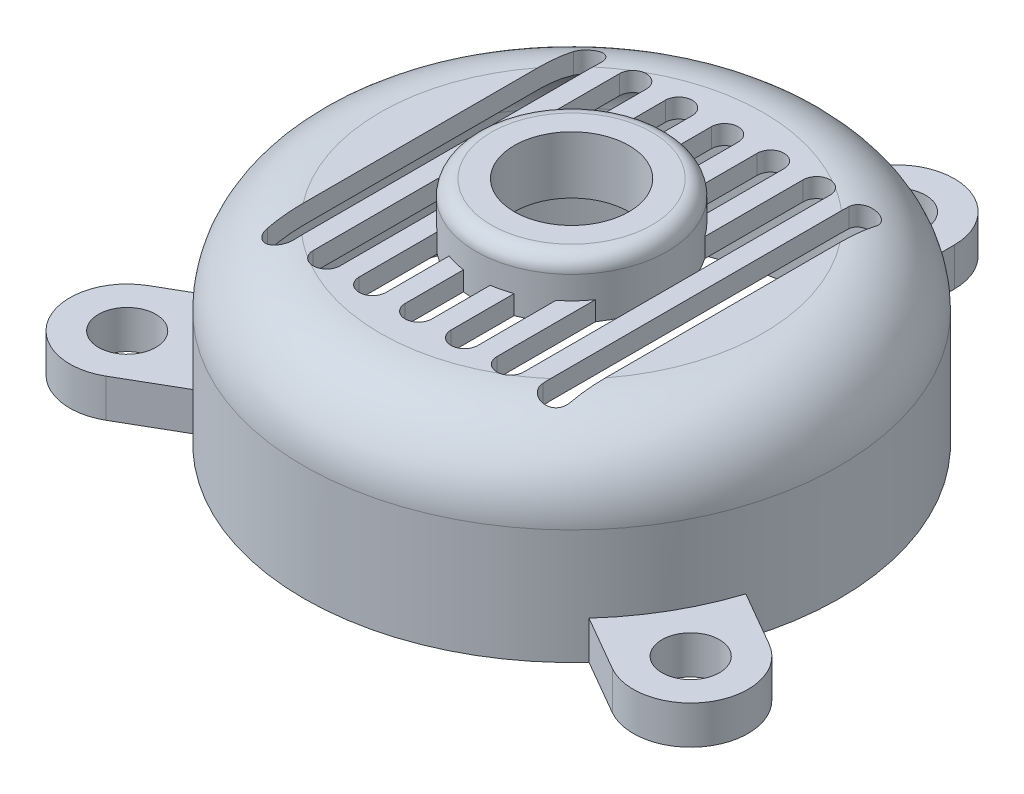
SolidWorks part; units mm, degrees
ref_plane "Front Plane" through (0, 0, 0) normal (0, 0, 1) x (1, 0, 0)
ref_plane "Top Plane" through (0, 0, 0) normal (0, 1, 0) x (1, 0, 0)
ref_plane "Right Plane" through (0, 0, 0) normal (1, 0, 0) x (0, 0, -1)
sketch "Sketch1" plane through (0, 0, 0) normal (0, 0, 1) x (1, 0, 0)
  line L0 (0, 25) -> (0, 0) construction
  line L1 (0, 0) -> (0, 25)
  line L2 (0, 25) -> (25, 25)
  line L3 (35, 15) -> (35, 0)
  line L4 (35, 0) -> (0, 0)
  arc A0 (25, 25) -> (35, 15) centre (25, 15) cw
  dimension "D1" = 10
  dimension "D2" = 70
  dimension "D3" = 25
revolve "Revolve1" add sketch "Sketch1" angle 360 about L0
shell "Shell1" thickness 2.5
sketch "Sketch2" plane through (0, 0, 0) normal (0, 1, 0) x (1, 0, 0)
  line L0 (0, 0) -> (0, 42.5) construction
  line L1 (-7.5, 42.5) -> (-7.5, 34.187)
  line L3 (7.5, 34.187) -> (7.5, 42.5)
  circle A0 centre (0, 0) radius 35 construction
  arc A1 (7.5, 34.187) -> (-7.5, 34.187) centre (0, 0) ccw
  arc A2 (-7.5, 42.5) -> (7.5, 42.5) centre (0, 42.5) cw
  circle A3 centre (0, 42.5) radius 3.75
  dimension "D2" = 7.5
  dimension "D3" = 7.5
  dimension "D1" = 42.5
extrude "Boss-Extrude1" add sketch "Sketch2" along normal blind 5
pattern_circular "CirPattern1" count 6 over 360 about axis through (0, 0, 0) along (0, 1, 0) of "Boss-Extrude1"
sketch "Sketch5" plane through (0, 25, 0) normal (0, 1, 0) x (1, 0, 0)
  line L0 (-18, 20) -> (-18, -20) construction
  line L1 (-16.25, 20) -> (-16.25, -20)
  line L2 (-19.75, 20) -> (-19.75, -20)
  arc A0 (-16.25, 20) -> (-19.75, 20) centre (-18, 20) ccw
  arc A1 (-19.75, -20) -> (-16.25, -20) centre (-18, -20) ccw
  point P2 (-18, 0)
  dimension "D2" = 3.5
  dimension "D1" = 40
  dimension "D3" = 18
  dimension "D4" = 20
extrude "Cut-Extrude2" cut sketch "Sketch5" against normal up to next
pattern_linear "LPattern1" count 7 spacing 6 along (1, 0, 0) of "Cut-Extrude2"
sketch "Sketch3" plane through (0, 22.5, 0) normal (0, 1, 0) x (1, 0, 0)
  circle A0 centre (0, 0) radius 12.5
  dimension "D1" = 25
extrude "Boss-Extrude2" add sketch "Sketch3" along normal blind 7.5
sketch "Sketch4" plane through (0, 30, 0) normal (0, 1, 0) x (1, 0, 0)
  circle A0 centre (0, 0) radius 7.5
  dimension "D1" = 15
extrude "Cut-Extrude1" cut sketch "Sketch4" against normal through all
fillet "Fillet1" radius 2 1 edges at (-12.5, 30, 0)
